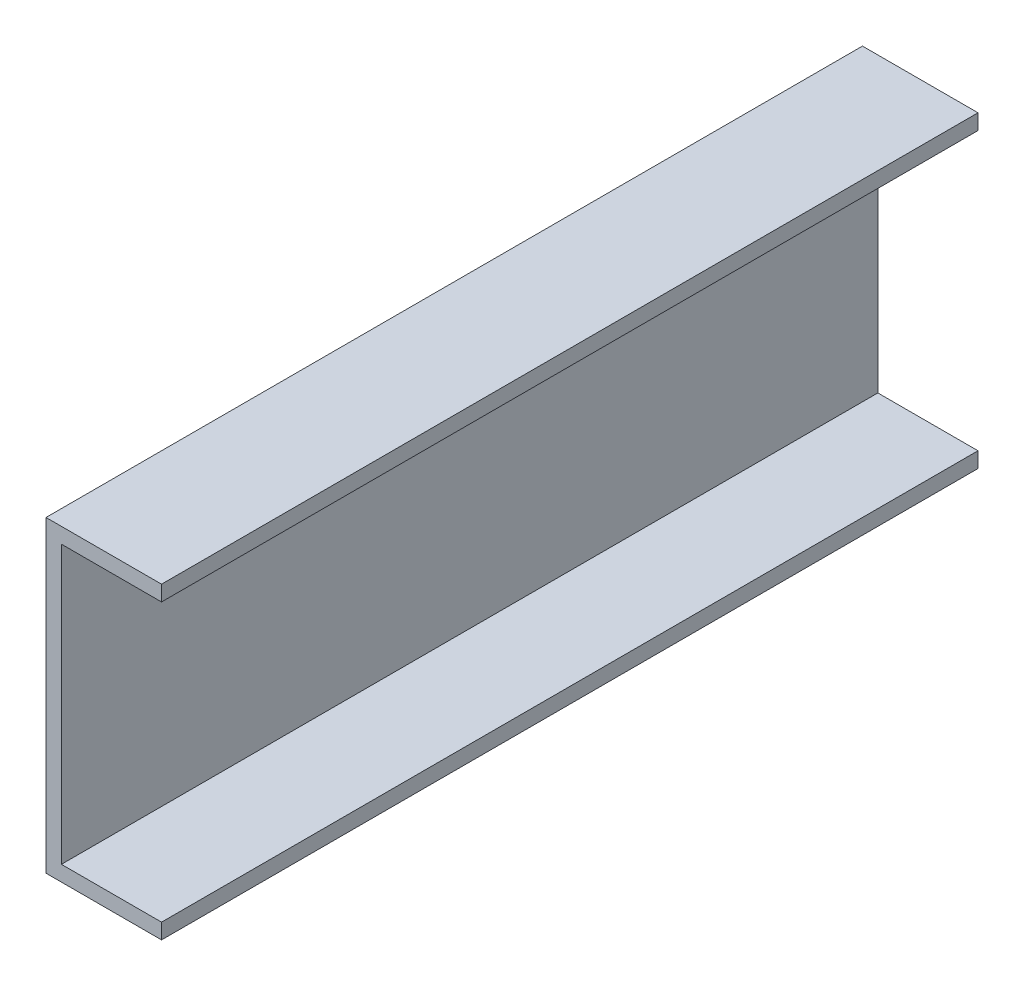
SolidWorks part; units mm, degrees
ref_plane "Front Plane" through (0, 0, 0) normal (0, 0, 1) x (1, 0, 0)
ref_plane "Top Plane" through (0, 0, 0) normal (0, 1, 0) x (1, 0, 0)
ref_plane "Right Plane" through (0, 0, 0) normal (1, 0, 0) x (0, 0, -1)
sketch "Sketch1" plane through (0, 0, 0) normal (0, 0, 1) x (1, 0, 0)
  line L0 (75, 0) -> (0, 0)
  line L1 (0, 0) -> (0, 200)
  line L2 (0, 200) -> (75, 200)
  line L3 (75, 200) -> (75, 190)
  line L4 (75, 190) -> (10, 190)
  line L5 (10, 190) -> (10, 10)
  line L6 (10, 10) -> (75, 10)
  line L7 (75, 10) -> (75, 0)
  dimension "D1" = 200
  dimension "D2" = 75
  dimension "D3" = 10
  dimension "D4" = 10
extrude "Boss-Extrude1" add sketch "Sketch1" along normal mid plane 530
